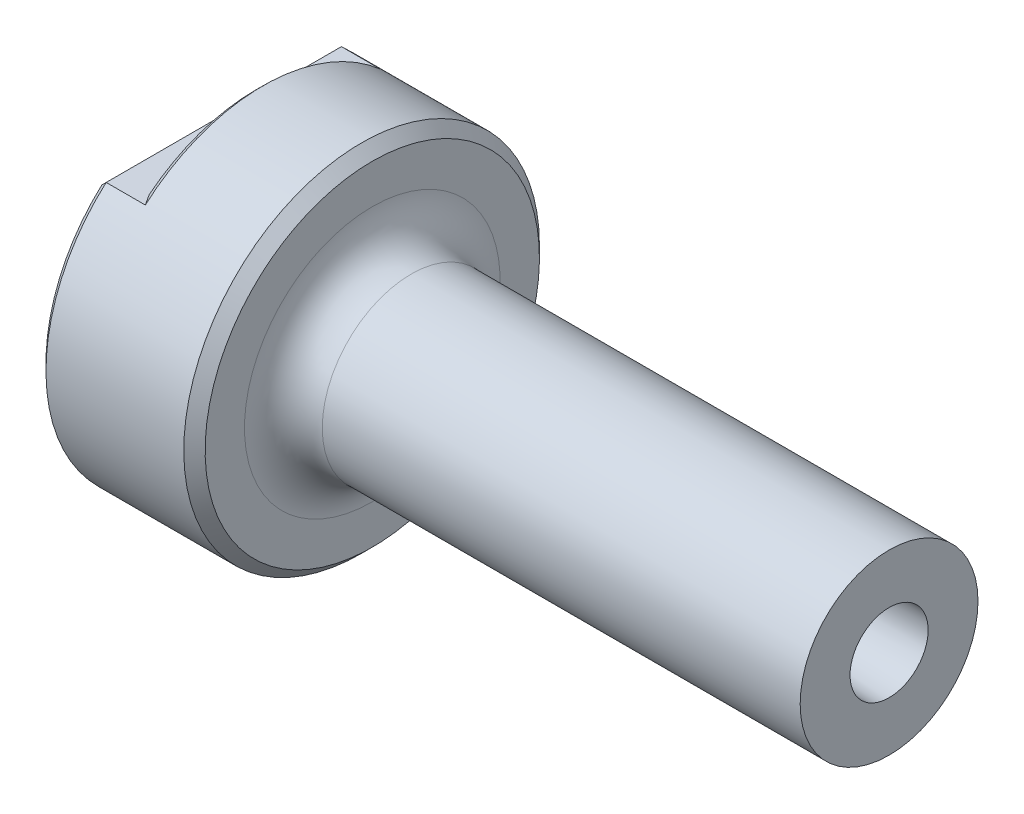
SolidWorks part; units mm, degrees
ref_plane "Front Plane" through (0, 0, 0) normal (0, 0, 1) x (1, 0, 0)
ref_plane "Top Plane" through (0, 0, 0) normal (0, 1, 0) x (1, 0, 0)
ref_plane "Right Plane" through (0, 0, 0) normal (1, 0, 0) x (0, 0, -1)
sketch "Sketch1" plane through (0, 0, 0) normal (1, 0, 0) x (0, 0, -1)
  circle A0 centre (0, 0) radius 25.4
  dimension "Rod Dia" = 50.8
extrude "Boss-Extrude1" add sketch "Sketch1" along normal mid plane 96.0438 contours A0
sketch "Sketch3" plane through (-48.0219, 0, 0) normal (-1, 0, 0) x (0, 0, 1)
  line L1 (-25.4, 25.4) -> (25.4, 25.4)
  line L2 (-25.4, 25.4) -> (-25.4, 19.05)
  line L3 (-25.4, 19.05) -> (25.4, 19.05)
  line L4 (25.4, 25.4) -> (25.4, 19.05)
  line L5 (-25.4, 25.4) -> (25.4, 19.05) construction
  line L6 (-25.4, 19.05) -> (25.4, 25.4) construction
  circle A0 centre (0, 0) radius 25.4 construction
  point P0 (0, 22.225)
  dimension "D1" = 19.05
extrude "Cut-Extrude1" cut sketch "Sketch3" against normal blind 5.588
sketch "Sketch5" plane through (0, 0, 0) normal (0, 0, 1) x (1, 0, 0)
  line L0 (48.0219, 0) -> (-48.0219, 0) construction
  line L1 (48.0219, -25.4) -> (48.0219, 25.4) construction
  line L2 (-48.0219, 19.05) -> (-48.0219, -25.4) construction
  line L3 (-25.7969, -12.7) -> (48.0219, -12.7)
  line L4 (48.0219, -12.7) -> (48.0219, -25.4)
  line L5 (48.0219, -25.4) -> (-25.7969, -25.4)
  line L6 (-48.0219, -25.4) -> (48.0219, -25.4) construction
  line L7 (-25.7969, -25.4) -> (-25.7969, -12.7)
  dimension "B" = 22.225
  dimension "D" = 25.4
revolve "Cut-Revolve1" cut sketch "Sketch5" angle 360 about L0
sketch "Sketch6" plane through (0, 0, 0) normal (0, 0, 1) x (1, 0, 0)
  line L0 (48.0219, 0) -> (-48.0219, 0) construction
  line L1 (48.0219, -12.7) -> (48.0219, 12.7) construction
  line L2 (-48.0219, 19.05) -> (-48.0219, -25.4) construction
  line L3 (-43.3991, 0) -> (-48.0219, 0)
  line L5 (-48.0219, 9.8005) -> (-48.0219, 0)
  arc A0 (-48.0219, 9.8005) -> (-43.3991, 0) centre (-56.0991, 0) cw
  dimension "D1" = 12.7
  dimension "D2" = 4.6228
revolve "Cut-Revolve2" cut sketch "Sketch6" angle 360 about L0
sketch "Sketch7" plane through (0, 0, 0) normal (0, 0, 1) x (1, 0, 0)
  line L0 (-43.9117, 3.5719) -> (48.0219, 5.5779)
  line L2 (48.0219, -12.7) -> (48.0219, 12.7) construction
  line L3 (-43.9117, 0) -> (48.0219, 0)
  line L4 (48.0219, 0) -> (-48.0219, 0) construction
  line L5 (-48.0219, 19.05) -> (-48.0219, -25.4) construction
  line L6 (48.0219, 5.5779) -> (48.0219, 0)
  line L7 (-43.9117, 3.5719) -> (-43.9117, 0)
  line L8 (48.0219, 0) -> (41.1743, 0.1051)
  arc A1 (-48.0219, -9.8005) -> (-48.0219, 9.8005) centre (-56.0991, 0) ccw construction
  dimension "D1" = 1.25
  dimension "D2" = 7.1437
revolve "Cut-Revolve3" cut sketch "Sketch7" angle 360 about L4
fillet "Fillet1" radius 5.5562 1 edges at (-25.7969, 12.7, 0)
chamfer "Chamfer1" distance 1.524 angle 45 1 edges at (-25.7969, 25.4, 0)
chamfer "Chamfer2" distance 1.016 angle 45 3 edges at (-42.4339, 25.4, 0) (-48.0219, -25.4, 0) (-48.0219, 19.05, 0)
